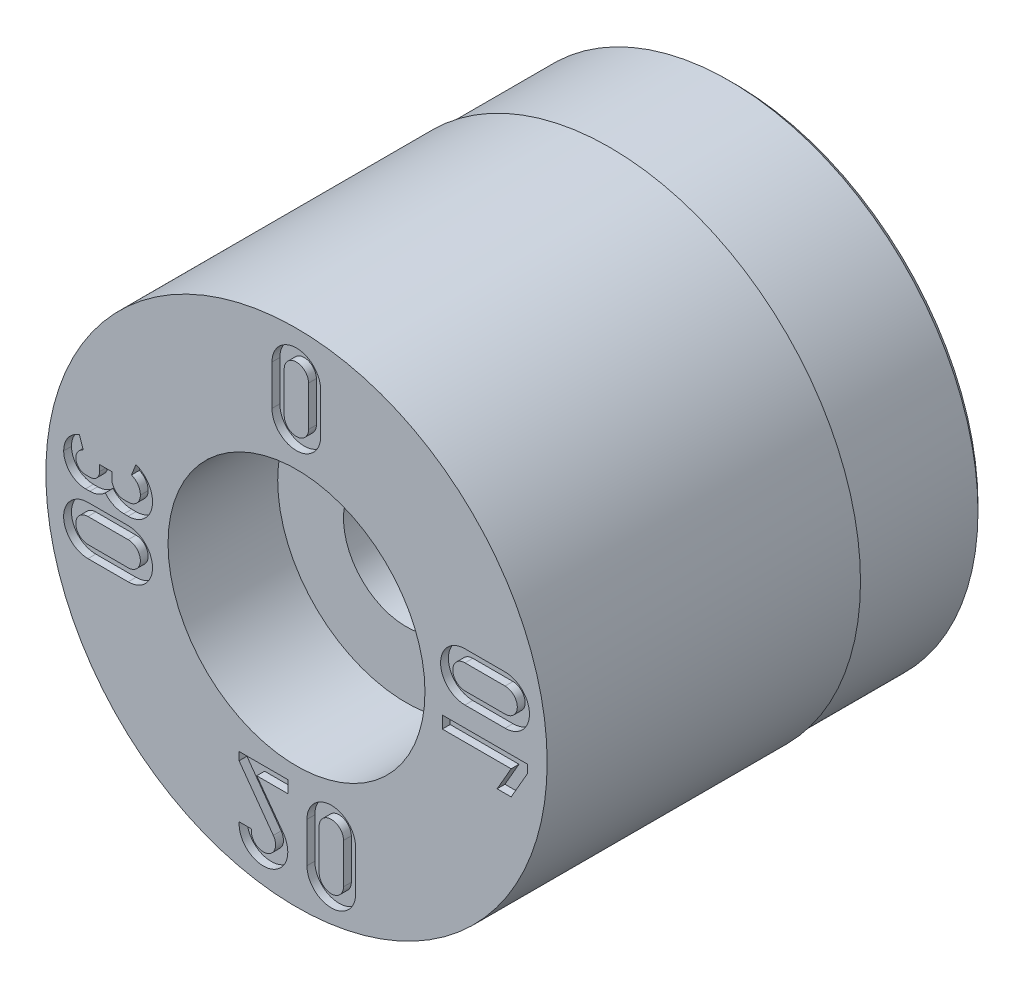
SolidWorks part; units mm, degrees
ref_plane "Front Plane" through (0, 0, 0) normal (0, 0, 1) x (1, 0, 0)
ref_plane "Top Plane" through (0, 0, 0) normal (0, 1, 0) x (1, 0, 0)
ref_plane "Right Plane" through (0, 0, 0) normal (1, 0, 0) x (0, 0, -1)
sketch "Sketch1" plane through (0, 0, 0) normal (1, 0, 0) x (0, 0, -1)
  line L2 (0, 8) -> (0, 4.1)
  line L3 (13.75, 8) -> (0, 8)
  line L4 (-3.7979, 0) -> (49996.2021, 0) construction
  line L8 (14, 2) -> (3.5, 2)
  line L9 (3.5, 4.1) -> (3.5, 2)
  line L10 (3.5, 4.1) -> (0, 4.1)
  line L12 (14, 2) -> (14, 7.75)
  line L16 (14, 7.75) -> (13.75, 8)
  dimension "D1" = 14
  dimension "D2" = 45
  dimension "D3" = 0.25
  dimension "D4" = 16
  dimension "D5" = 8.2
  dimension "D6" = 3.5
  dimension "D7" = 4
revolve "Revolve1" add sketch "Sketch1" angle 360 about L4
sketch "Sketch4" plane through (0, 0, 0) normal (1, 0, 0) x (0, 0, -1)
  line L0 (0, 0) -> (50000, 0) construction
  line L1 (14, -7.75) -> (14, 7.75) construction
  line L2 (10, 8.935) -> (14, 8.935)
  line L3 (10, 8.935) -> (10, 7.935)
  line L4 (10, 7.935) -> (14, 7.935)
  line L5 (14, 8.935) -> (14, 7.935)
  line L6 (13.75, 8) -> (0, 8) construction
  line L9 (0, 55) -> (0, -55) construction
  dimension "D1" = 1
  dimension "D2" = 0.065
  dimension "D3" = 10
revolve "Cut-Revolve1" cut sketch "Sketch4" angle 360 about L0
sketch "Sketch2" plane through (0, 0, 0) normal (0, 0, 1) x (1, 0, 0)
  line L920 (0.7221, -5.4066) -> (0.7223, -6.6888)
  line L921 (1.4993, -6.6888) -> (1.4994, -5.4065)
  line L922 (1.888, -6.6887) -> (1.8881, -5.4065)
  line L923 (0.3334, -5.4066) -> (0.3335, -6.6889)
  line L924 (-5.3716, 0.507) -> (-5.5076, 0.507)
  line L925 (-5.8961, 0.8955) -> (-5.8961, 1.0897)
  line L926 (-5.8961, 1.0897) -> (-6.2847, 1.0898)
  line L927 (-6.2847, 1.0898) -> (-6.2847, 0.8956)
  line L928 (-6.5956, 0.5848) -> (-6.7315, 0.5848)
  line L929 (-6.8046, 1.2269) -> (-6.9289, 1.5951)
  line L930 (-6.7315, 0.1962) -> (-6.5956, 0.1961)
  line L931 (-5.5077, 0.1184) -> (-5.3716, 0.1184)
  line L932 (-5.1233, 1.6726) -> (-5.2659, 1.3113)
  line L933 (6.6581, 1.8286) -> (5.3758, 1.8287)
  line L934 (5.3759, 0.2742) -> (6.6582, 0.2743)
  line L935 (5.3759, 0.6628) -> (6.6582, 0.6629)
  line L936 (6.6581, 1.4399) -> (5.3758, 1.4401)
  line L937 (7.3743, -0.3626) -> (7.3744, -0.6183)
  line L938 (7.3744, -0.6183) -> (6.8512, -1.5283)
  line L939 (6.8512, -1.5283) -> (6.4031, -1.5283)
  line L940 (6.4031, -1.5283) -> (6.8498, -0.7511)
  line L941 (6.8498, -0.7511) -> (4.6545, -0.7513)
  line L942 (4.6545, -0.7513) -> (4.6544, -0.3628)
  line L943 (4.6544, -0.3628) -> (7.3743, -0.3626)
  line L944 (-0.2781, -5.0027) -> (-0.2782, -4.6141)
  line L945 (-0.2782, -4.6141) -> (-1.8324, -4.6142)
  line L946 (-1.8324, -4.6142) -> (-1.8324, -4.8712)
  line L947 (-1.8324, -4.8712) -> (-0.7396, -6.3881)
  line L948 (-1.4393, -6.557) -> (-1.8301, -6.557)
  line L949 (-0.4239, -6.1606) -> (-1.2691, -5.0028)
  line L950 (-1.2691, -5.0028) -> (-0.2781, -5.0027)
  line L951 (-0.7819, 6.6756) -> (-0.7818, 5.3934)
  line L952 (0.7727, 5.3935) -> (0.7728, 6.6757)
  line L953 (0.3841, 5.3934) -> (0.384, 6.6757)
  line L954 (-0.393, 6.6756) -> (-0.3931, 5.3933)
  line L955 (-5.3727, -1.3071) -> (-6.6549, -1.3068)
  line L956 (-6.6549, -0.5298) -> (-5.3726, -0.5297)
  line L957 (-6.6548, -0.141) -> (-5.3726, -0.1411)
  line L958 (-5.3727, -1.6956) -> (-6.655, -1.6955)
  arc A432 (1.4994, -5.4065) -> (0.7221, -5.4066) centre (1.1108, -5.4065) ccw
  arc A433 (0.7223, -6.6888) -> (1.4993, -6.6888) centre (1.1108, -6.6888) ccw
  arc A434 (1.8881, -5.4065) -> (0.3334, -5.4066) centre (1.1108, -5.4065) ccw
  arc A435 (0.3335, -6.6889) -> (1.888, -6.6887) centre (1.1108, -6.6888) ccw
  arc A436 (-4.9831, 0.8955) -> (-5.2659, 1.3113) centre (-5.43, 0.8955) ccw
  arc A437 (-5.3716, 0.507) -> (-4.9831, 0.8955) centre (-5.3716, 0.8955) ccw
  arc A438 (-5.8961, 0.8955) -> (-5.5076, 0.507) centre (-5.5076, 0.8955) ccw
  arc A439 (-6.5956, 0.5848) -> (-6.2847, 0.8956) centre (-6.5955, 0.8956) ccw
  arc A440 (-7.0424, 0.8956) -> (-6.7315, 0.5848) centre (-6.7312, 0.8959) ccw
  arc A441 (-6.8046, 1.2269) -> (-7.0424, 0.8956) centre (-6.6931, 0.8959) ccw
  arc A442 (-6.9289, 1.5951) -> (-7.4309, 0.8957) centre (-6.6925, 0.8955) ccw
  arc A443 (-7.4309, 0.8957) -> (-6.7315, 0.1962) centre (-6.7316, 0.8955) ccw
  arc A444 (-6.5956, 0.1961) -> (-6.1044, 0.3977) centre (-6.5955, 0.8953) ccw
  arc A445 (-6.1044, 0.3977) -> (-5.5077, 0.1184) centre (-5.5078, 0.8952) ccw
  arc A446 (-5.3716, 0.1184) -> (-4.5945, 0.8954) centre (-5.3715, 0.8954) ccw
  arc A447 (-4.5945, 0.8954) -> (-5.1233, 1.6726) centre (-5.4302, 0.8954) ccw
  arc A448 (5.3758, 1.8287) -> (5.3759, 0.2742) centre (5.3759, 1.0514) ccw
  arc A449 (6.6582, 0.2743) -> (6.6581, 1.8286) centre (6.6581, 1.0514) ccw
  arc A450 (5.3758, 1.4401) -> (5.3759, 0.6628) centre (5.3759, 1.0514) ccw
  arc A451 (6.6582, 0.6629) -> (6.6581, 1.4399) centre (6.6581, 1.0514) ccw
  arc A452 (-1.4393, -6.557) -> (-0.7396, -6.3881) centre (-1.055, -6.6153) ccw
  arc A453 (-1.8301, -6.557) -> (-0.4239, -6.1606) centre (-1.0548, -6.6148) ccw
  arc A454 (-0.7818, 5.3934) -> (0.7727, 5.3935) centre (-0.0045, 5.3934) ccw
  arc A455 (0.7728, 6.6757) -> (-0.7819, 6.6756) centre (-0.0045, 6.6757) ccw
  arc A456 (-0.3931, 5.3933) -> (0.3841, 5.3934) centre (-0.0045, 5.3934) ccw
  arc A457 (0.384, 6.6757) -> (-0.393, 6.6756) centre (-0.0045, 6.6757) ccw
  arc A458 (-5.3727, -1.3071) -> (-5.3726, -0.5297) centre (-5.3726, -0.9184) ccw
  arc A459 (-6.6549, -0.5298) -> (-6.6549, -1.3068) centre (-6.6549, -0.9183) ccw
  arc A460 (-5.3727, -1.6956) -> (-5.3726, -0.1411) centre (-5.3726, -0.9184) ccw
  arc A461 (-6.6548, -0.141) -> (-6.655, -1.6955) centre (-6.6549, -0.9183) ccw
  point P1778 (0, 0.0125)
  point P1779 (0.0125, 0.0125)
  point P1780 (0.0125, 0)
extrude "Cut-Extrude1" cut sketch "Sketch2" against normal blind 0.25
